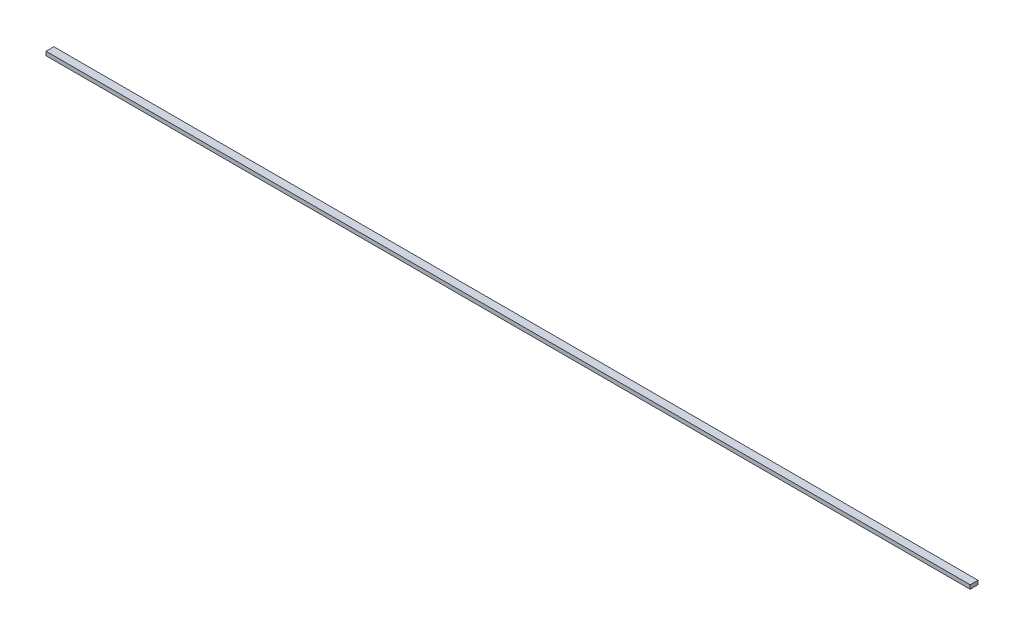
SolidWorks part; units mm, degrees
ref_plane "Front Plane" through (0, 0, 0) normal (0, 0, 1) x (1, 0, 0)
ref_plane "Top Plane" through (0, 0, 0) normal (0, 1, 0) x (1, 0, 0)
ref_plane "Right Plane" through (0, 0, 0) normal (1, 0, 0) x (0, 0, -1)
sketch "Sketch1" plane through (0, 0, 0) normal (0, 1, 0) x (1, 0, 0)
  line L1 (-90.333, 18.5452) -> (2906.867, 18.5452)
  line L2 (-90.333, 18.5452) -> (-90.333, 43.9452)
  line L3 (-90.333, 43.9452) -> (2906.867, 43.9452)
  line L4 (2906.867, 18.5452) -> (2906.867, 43.9452)
  dimension "D1" = 2997.2
  dimension "D2" = 25.4
extrude "Boss-Extrude1" add sketch "Sketch1" along normal blind 12.7
